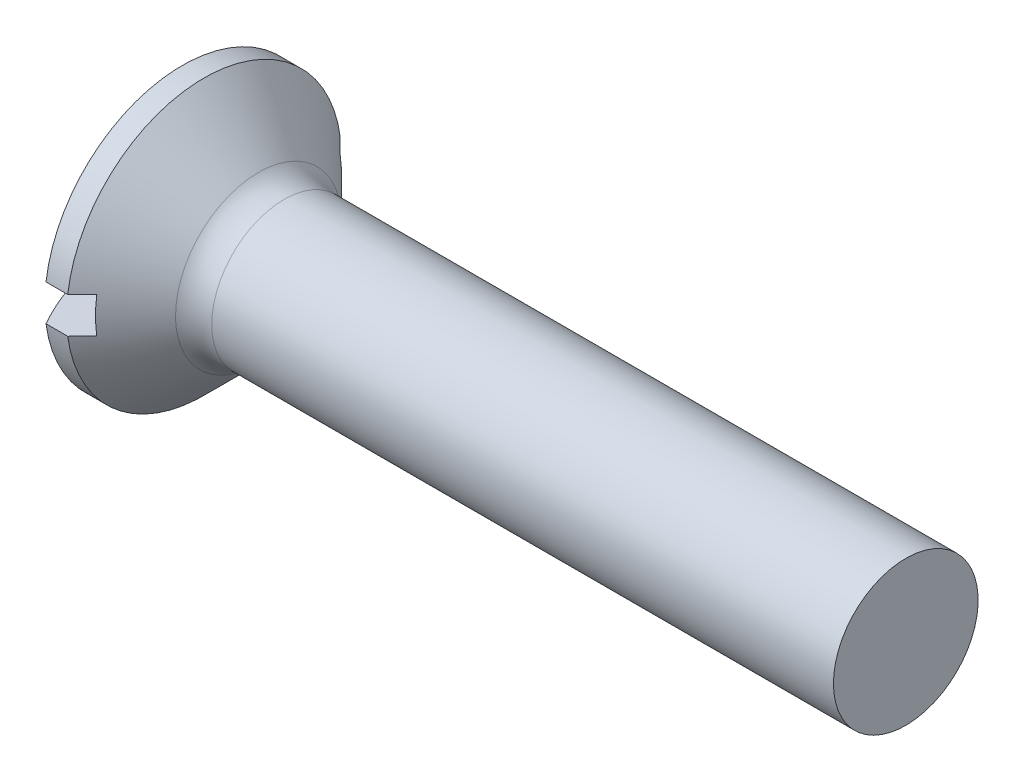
SolidWorks part; units mm, degrees
ref_plane "Plane1" through (0, 0, 0) normal (0, 0, 1) x (1, 0, 0)
ref_plane "Plane2" through (0, 0, 0) normal (0, 1, 0) x (1, 0, 0)
ref_plane "Plane3" through (0, 0, 0) normal (1, 0, 0) x (0, 0, -1)
revolve "Base-Revolve" add sketch "BodySke"
sketch "BodySke" plane through (0, 0, 0) normal (0, 0, 1) x (1, 0, 0)
  line L0 (0, 0) -> (10.5, 0)
  line L1 (10.5, 0) -> (10.5, 1)
  line L2 (10.5, 1) -> (1.7, 1)
  line L3 (0.8, -1.9) -> (1.7, -1) construction
  line L4 (-15.875, 0) -> (82.55, 0) construction
  line L5 (0.8, 1.9) -> (1.7, 1)
  line L6 (2.1, 4.175) -> (2.1, -11.7) construction
  line L7 (0.5, 2.7793) -> (0.5, -13.0957) construction
  line L8 (0.8, 1.9) -> (0.5, 1.9)
  arc A0 (0, 0) -> (0.5, 1.9) centre (3.86, 0) cw
  dimension "Length" = 10
  dimension "Diameter" = 2
  dimension "Head_dia" = 3.8
  dimension "Head_ang" = 90
  dimension "Advance" = 0.4
  dimension "Thread_nom" = 10
  dimension "Oval_ht" = 0.5
  dimension "Side_ht" = 1.2
extrude "Slot" cut sketch "Sketch2" along normal blind 1
sketch "Sketch2" plane through (0, 0, 0) normal (1, 0, 0) x (0, 0, -1)
  line L0 (1.9, -0.25) -> (-1.9, -0.25)
  line L1 (1.9, -0.25) -> (1.9, 0.25)
  line L2 (-1.9, 0.25) -> (1.9, 0.25)
  line L3 (-1.9, 0.25) -> (-1.9, -0.25)
  dimension "D1" = 3.8
  dimension "Slot_width" = 0.5
  dimension "D3" = 1.9
  dimension "D4" = 0.25
fillet "Fillet1" radius 0.5 1 edges at (1.7, 0, 1)
sketch "ThdSchSke" plane through (0, 0, 0) normal (0, 0, 1) x (1, 0, 0)
  line L0 (2.1, -0.774) -> (1.9418, -1)
  line L1 (2.1, -0.774) -> (2.2582, -1)
  line L2 (2.2582, -1) -> (2.2582, -1.25)
  line L3 (-3.175, 0) -> (5.1513, 0) construction
  line L5 (2.2582, -1.25) -> (1.9418, -1.25)
  line L6 (1.9418, -1.25) -> (1.9418, -1)
  dimension "Thread_minor" = 1.548
  dimension "Diameter" = 2
  dimension "Start" = 2.1
  dimension "SideAngle" = 55
  dimension "VeeAngle" = 70
  dimension "Overcut" = 2.5
revolve "ThreadSchematic" [suppressed] cut sketch "ThdSchSke" angle 360 about L3
pattern_linear "ThdSchPat" [suppressed]
equation "\"D1@Sketch2\" = \"Head_dia@BodySke\""
equation "\"D3@Sketch2\" = \"D1@Sketch2\" / 2"
equation "\"D4@Sketch2\" = \"Slot_width@Sketch2\" / 2"
equation "\"Thread_length@ThreadCosmetic\" = ((sgn( (\"Length@BodySke\" - \"Advance@BodySke\" - \"Side_ht@BodySke\" ) - \"Thread_nom@BodySke\" )-1)*( (\"Length@BodySke\" - \"Advance@BodySke\" - \"Side_ht@BodySke\" ) - \"Thread_"
equation "\"Thread_minor@ThdSchSke\" = \"Thread_minor@ThreadCosmetic\""
equation "\"Diameter@ThdSchSke\" = \"Diameter@BodySke\""
equation "\"Overcut@ThdSchSke\" = \"Diameter@BodySke\" * 1.25"
equation "\"Start@ThdSchSke\" = \"Oval_ht@BodySke\" + \"Length@BodySke\" - \"Thread_length@ThreadCosmetic\"  '---Countersunk---"
equation "\"Num_threads@ThdSchPat\" = int( \"Thread_length@ThreadCosmetic\" / \"Advance@BodySke\" + 0.999 )  + 1"
equation "\"Advance@ThdSchPat\" = \"Thread_length@ThreadCosmetic\" /  (\"Num_threads@ThdSchPat\" - 1) 'relax it"
